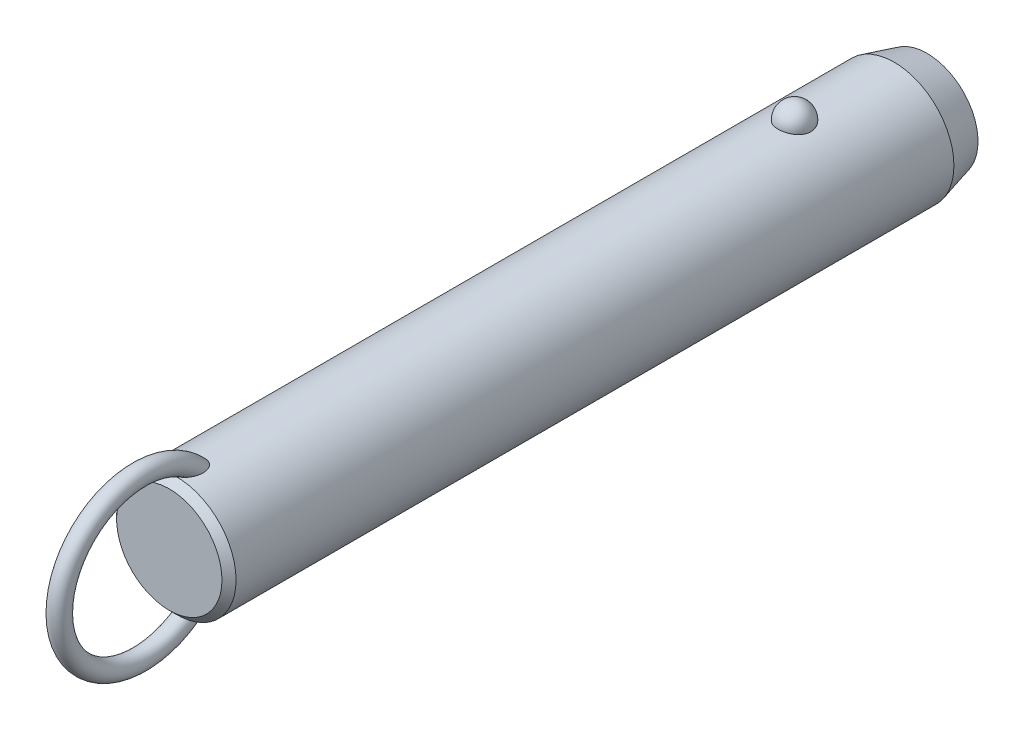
SolidWorks part; units mm, degrees
ref_plane "Front Plane" through (0, 0, 0) normal (0, 0, 1) x (1, 0, 0)
ref_plane "Top Plane" through (0, 0, 0) normal (0, 1, 0) x (1, 0, 0)
ref_plane "Right Plane" through (0, 0, 0) normal (1, 0, 0) x (0, 0, -1)
sketch "Sketch2" plane through (0, 0, 0) normal (0, 0, 1) x (1, 0, 0)
  circle A0 centre (0, 0) radius 12.7
  point P3 (0, 12.7)
  dimension "D1" = 25.4
extrude "Boss-Extrude1" add sketch "Sketch2" along normal blind 116.8
sketch "Sketch3" plane through (0, 0, 0) normal (0, 0, -1) x (-1, 0, 0)
  circle A0 centre (0, 0) radius 12.7
  dimension "D1" = 25.4
extrude "Boss-Extrude2" add sketch "Sketch3" along normal blind 31.7
chamfer "Chamfer1" distance 7 angle 15 1 edges at (-12.7, 0, -31.7)
sketch "Sketch12" plane through (0, 0, 0) normal (1, 0, 0) x (0, 0, -1)
  line L0 (-116.8, 12.7) -> (-116.8, -12.7) construction
  point P0 (-116.8, 0)
sketch "Sketch13" plane through (0, 0, 0) normal (1, 0, 0) x (0, 0, -1)
  circle A0 centre (-135.85, 0) radius 19.05
  point P2 (-116.8, 0)
  dimension "D1" = 38.1
sketch "Sketch14" plane through (0, 0, 0) normal (0, 1, 0) x (1, 0, 0)
  circle A0 centre (0, -118.8) radius 2
  point P2 (0, -116.8)
  dimension "D1" = 4
sweep "Sweep1" add profiles "Sketch14" path "Sketch13"
sketch "Sketch15" plane through (0, 0, 116.8) normal (0, 0, 1) x (1, 0, 0)
  circle A0 centre (0, 0) radius 12.7
  dimension "D1" = 25.4
extrude "Boss-Extrude3" add sketch "Sketch15" along normal blind 12.7
chamfer "Chamfer2" distance 1.5 angle 45 1 edges at (12.7, 0, 129.5)
sketch "Sketch18" plane through (0, 0, 0) normal (1, 0, 0) x (0, 0, -1)
  line L0 (24.7, 12.7) -> (-121.651, 12.7) construction
  line L1 (3.5, 16.2) -> (3.5, 9.2)
  line L2 (-121.651, -12.7) -> (24.7, -12.7) construction
  arc A0 (3.5, 16.2) -> (3.5, 9.2) centre (3.5, 12.7) ccw
  point P4 (0, 12.7)
  dimension "D1" = 28.9
revolve "Revolve1" add sketch "Sketch18" angle 360 about L1
